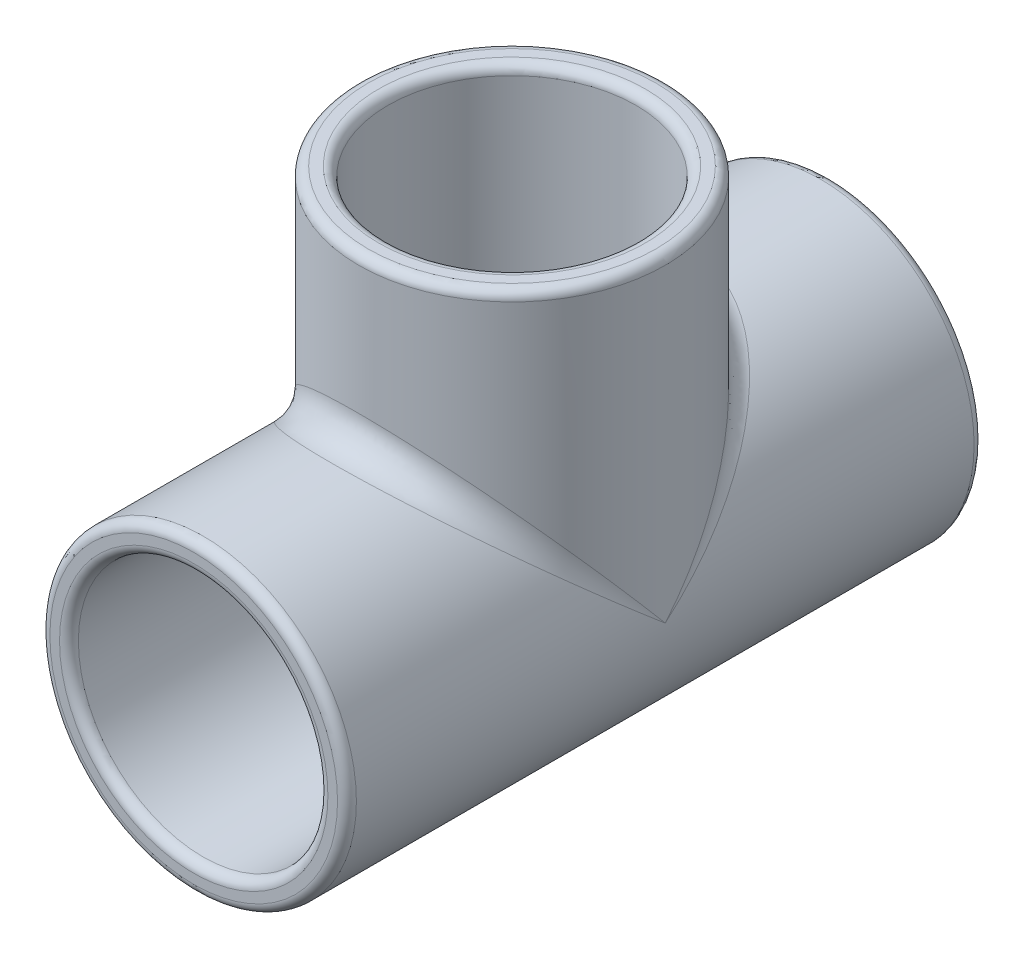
SolidWorks part; units mm, degrees
ref_plane "Front" through (0, 0, 0) normal (0, 0, 1) x (1, 0, 0)
ref_plane "Top" through (0, 0, 0) normal (0, 1, 0) x (1, 0, 0)
ref_plane "Right" through (0, 0, 0) normal (1, 0, 0) x (0, 0, -1)
sketch "Sketch1" plane through (0, 0, 0) normal (0, 0, 1) x (1, 0, 0)
  circle A0 centre (0, 0) radius 20.6375
  circle A1 centre (0, 0) radius 16.8021
  dimension "D1" = 41.275
  dimension "D2" = 33.6042
extrude "Extrude1" add sketch "Sketch1" along normal blind 85.725
sketch "Sketch2" plane through (0, 0, 0) normal (0, 1, 0) x (1, 0, 0)
  line L0 (20.6375, -85.725) -> (20.6375, 0) construction
  line L1 (20.6375, -85.725) -> (20.6375, 0) construction
  line L2 (-20.6375, 0) -> (-20.6375, -85.725) construction
  line L3 (-20.6375, 0) -> (-20.6375, -85.725) construction
  line L4 (20.6375, 0) -> (-20.6375, 0) construction
  circle A0 centre (0, -42.8625) radius 20.6375
  circle A1 centre (0, -42.8625) radius 16.7005
  dimension "D1" = 33.401
  dimension "D2" = 42.8625
extrude "Extrude2" add sketch "Sketch2" along normal blind 42.9895
sketch "Sketch4" plane through (0, 0, 85.725) normal (0, 0, 1) x (1, 0, 0)
  circle A0 centre (0, 0) radius 16.8021 construction
  circle A1 centre (0, 0) radius 16.8021
extrude "Cut-Extrude2" cut sketch "Sketch4" against normal blind 89.1794
sketch "Sketch5" plane through (0, 42.9895, 0) normal (0, 1, 0) x (-1, 0, 0)
  circle A0 centre (0, 42.8625) radius 16.7005 construction
  circle A1 centre (0, 42.8625) radius 16.7005
extrude "Cut-Extrude3" cut sketch "Sketch5" against normal blind 42.9895
sketch "Sketch8" plane through (0, 0, 0) normal (0, 0, 1) x (1, 0, 0)
  circle A0 centre (0, 0) radius 14.3479
  circle A1 centre (0, 0) radius 16.8853
extrude "Extrude3" add sketch "Sketch8" along normal blind 73.9394
sketch "Sketch9" plane through (0, 0, 0) normal (0, 0, -1) x (-1, 0, 0)
  circle A0 centre (0, 0) radius 16.8021
  dimension "D1" = 33.6042
extrude "Cut-Extrude4" cut sketch "Sketch9" against normal blind 25.4
sketch "Sketch10" plane through (0, 0, 85.725) normal (0, 0, 1) x (1, 0, 0)
  circle A1 centre (0, 0) radius 16.8021 construction
  circle A2 centre (0, 0) radius 16.8021
extrude "Cut-Extrude5" cut sketch "Sketch10" against normal blind 25.4
sketch "Sketch11" plane through (0, 42.9895, 0) normal (0, 1, 0) x (-1, 0, 0)
  circle A0 centre (0, 42.8625) radius 16.7005 construction
  circle A1 centre (0, 42.8625) radius 16.7005
extrude "Cut-Extrude6" cut sketch "Sketch11" against normal blind 42.9895
sketch "Sketch13" plane through (0, 0, 0) normal (0, 1, 0) x (1, 0, 0)
  circle A0 centre (0, -42.8625) radius 16.7005 construction
  circle A1 centre (0, -42.8625) radius 16.7005
  circle A2 centre (0, -42.8625) radius 13.82
extrude "Extrude4" add sketch "Sketch13" along normal blind 42.9895
sketch "Sketch15" plane through (0, 0, 0) normal (0, 0, -1) x (-1, 0, 0)
  circle A0 centre (0, 0) radius 14.3479 construction
  circle A1 centre (0, 0) radius 14.3479
extrude "Cut-Extrude8" cut sketch "Sketch15" against normal through all
sketch "Sketch16" plane through (0, 42.9895, 0) normal (0, 1, 0) x (1, 0, 0)
  circle A0 centre (0, -42.8625) radius 16.7005
extrude "Cut-Extrude9" cut sketch "Sketch16" against normal blind 25.4
fillet "Fillet1" radius 3.81 2 edges at (0, 20.6375, 63.5) (0, 20.6375, 22.225)
fillet "Fillet2" radius 1.27 6 edges at (-16.8021, 0, 0) (20.6375, 0, 0) (16.8021, 0, 85.725) (20.6375, 0, 85.725) (0, 42.9895, 63.5) (0, 42.9895, 59.563)
ref_plane "Plane1" through (-20.6375, 0, 42.8625) normal (-1, 0, 0) x (0, 0, 1)
sketch "Sketch17" plane through (-20.6375, 0, 42.8625) normal (-1, 0, 0) x (0, 0, 1)
  circle A0 centre (0, 0) radius 12.7
  dimension "D1" = 25.4
extrude "Cut-Extrude10" cut sketch "Sketch17" against normal up to surface (20.6375 mm away)
